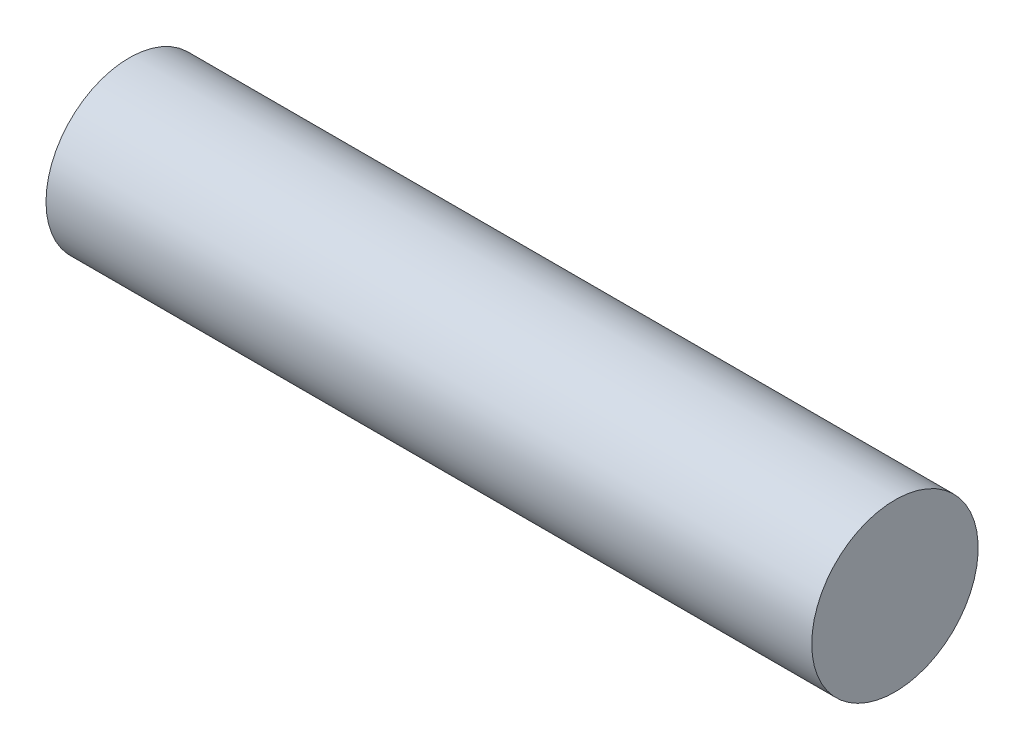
SolidWorks part; units mm, degrees
ref_plane "前视基准面" through (0, 0, 0) normal (0, 0, 1) x (1, 0, 0)
ref_plane "上视基准面" through (0, 0, 0) normal (0, 1, 0) x (1, 0, 0)
ref_plane "右视基准面" through (0, 0, 0) normal (1, 0, 0) x (0, 0, -1)
sketch "草图1" plane through (0, 0, 0) normal (1, 0, 0) x (0, 0, -1)
  circle A0 centre (0, 0) radius 2.825
  dimension "D1" = 5.65
extrude "凸台-拉伸1" add sketch "草图1" along normal blind 26
sketch "Sketch1" plane through (0, 0, 0) normal (0, 1, 0) x (1, 0, 0)
  line L0 (0, 0) -> (26, 0)
  line L1 (26, -2.825) -> (26, 2.825) construction
sketch "Sketch2" plane through (0, 0, 0) normal (-1, 0, 0) x (0, 0, 1)
  line L0 (-1.4133, 0.75) -> (-1.4133, -0.75)
  circle A0 centre (0, 0) radius 1.6
  dimension "D1" = 3.2
  dimension "D2" = 1.5
extrude "Cut-Extrude1" cut sketch "Sketch2" against normal blind 8.67 contours L0 A0
